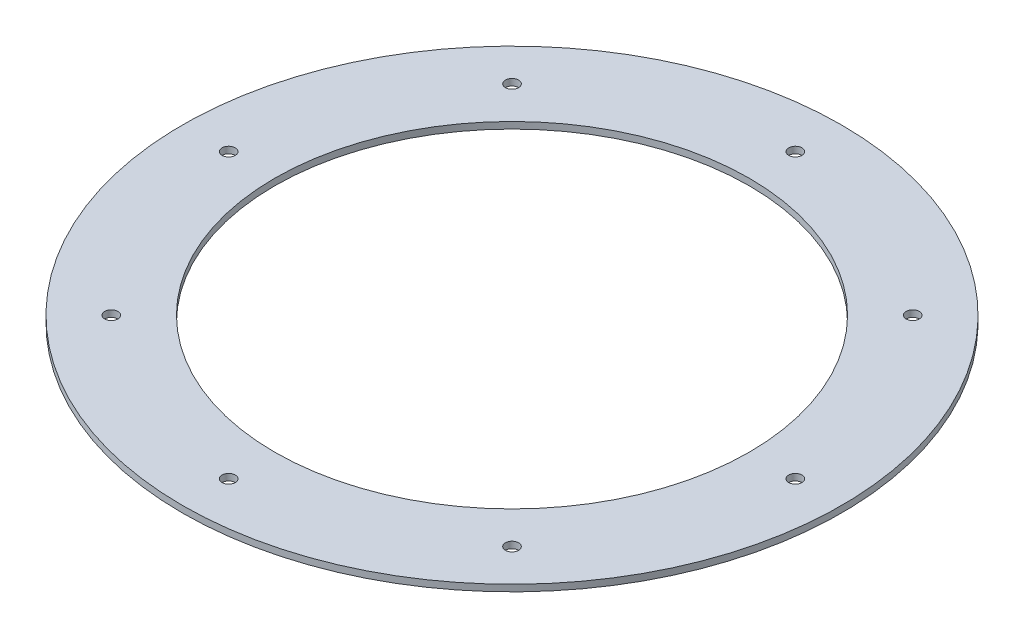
SolidWorks part; units mm, degrees
ref_plane "Front Plane" through (0, 0, 0) normal (0, 0, 1) x (1, 0, 0)
ref_plane "Top Plane" through (0, 0, 0) normal (0, 1, 0) x (1, 0, 0)
ref_plane "Right Plane" through (0, 0, 0) normal (1, 0, 0) x (0, 0, -1)
body saved out of another part "Stock-base-1"
